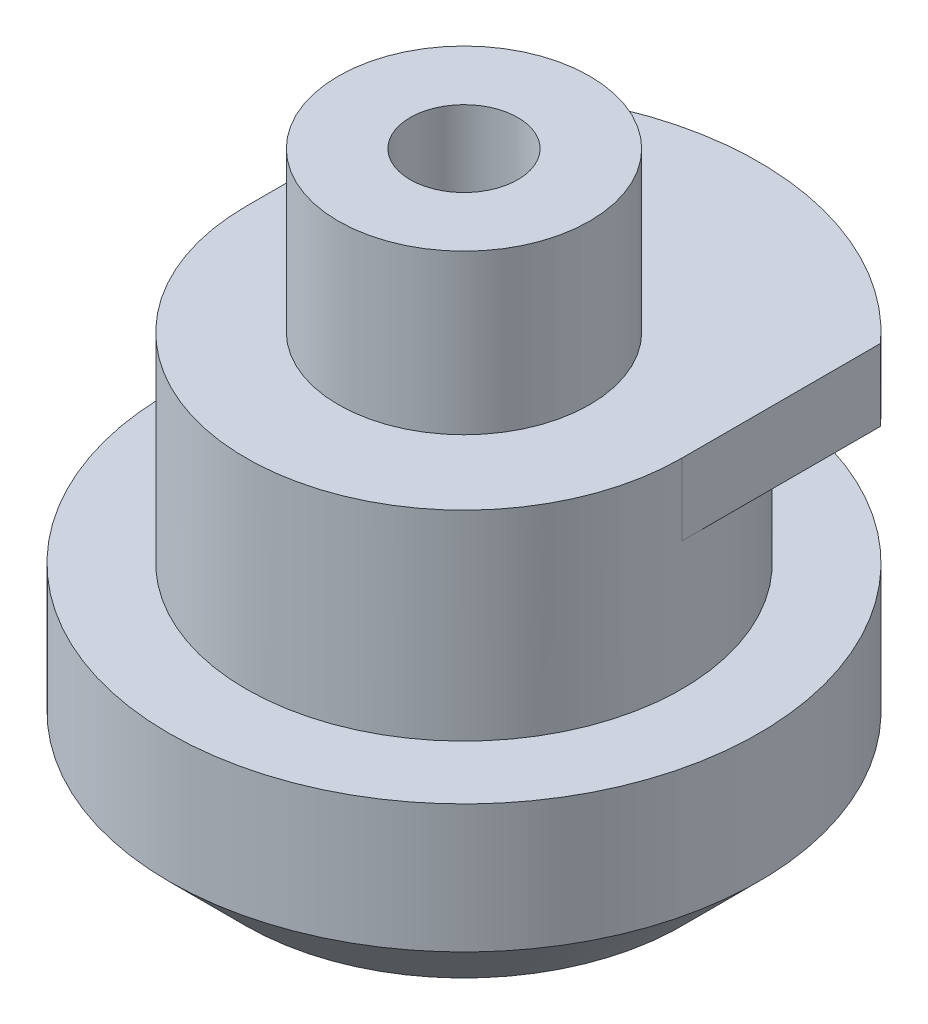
SolidWorks part; units mm, degrees
ref_plane "Front Plane" through (0, 0, 0) normal (0, 0, 1) x (1, 0, 0)
ref_plane "Top Plane" through (0, 0, 0) normal (0, 1, 0) x (1, 0, 0)
ref_plane "Right Plane" through (0, 0, 0) normal (1, 0, 0) x (0, 0, -1)
sketch "Sketch1" plane through (0, 0, 0) normal (0, 1, 0) x (1, 0, 0)
  circle A0 centre (0, 0) radius 11.5
  dimension "D1" = 23
extrude "Extrude1" add sketch "Sketch1" along normal blind 8
chamfer "Chamfer1" distance 3 angle 45 1 edges at (0, 0, 11.5)
sketch "Sketch2" plane through (0, 8, 0) normal (0, 1, 0) x (1, 0, 0)
  circle A0 centre (0, 0) radius 8.5
  dimension "D1" = 17
extrude "Extrude2" add sketch "Sketch2" along normal blind 7.8
sketch "Sketch3" plane through (0, 15.8, 0) normal (0, 1, 0) x (1, 0, 0)
  circle A0 centre (0, 0) radius 4.9
  dimension "D1" = 9.8
extrude "Extrude3" add sketch "Sketch3" along normal blind 6.2
sketch "Sketch6" plane through (0, 0, 0) normal (0, -1, 0) x (1, 0, 0)
  circle A0 centre (0, 0) radius 2.5
  dimension "D1" = 5
extrude "Extrude4" cut sketch "Sketch6" against normal blind 13.5
sketch "Sketch7" plane through (0, 22, 0) normal (0, 1, 0) x (1, 0, 0)
  circle A0 centre (0, 0) radius 2.1
  dimension "D1" = 4.2
extrude "Extrude5" cut sketch "Sketch7" against normal through all
sketch "Sketch8" plane through (0, 15.8, 0) normal (0, 1, 0) x (1, 0, 0)
  line L0 (8.5, 0) -> (8.5, 7.746)
  line L1 (-8.5, 0) -> (-8.5, 7.746)
  arc A0 (-8.5, 0) -> (8.5, 0) centre (0, 0) ccw
  arc A1 (8.5, 7.746) -> (-8.5, 7.746) centre (0, 0) ccw
  circle A2 centre (0, 0) radius 6.9512
extrude "Extrude6" add sketch "Sketch8" against normal blind 2.8
